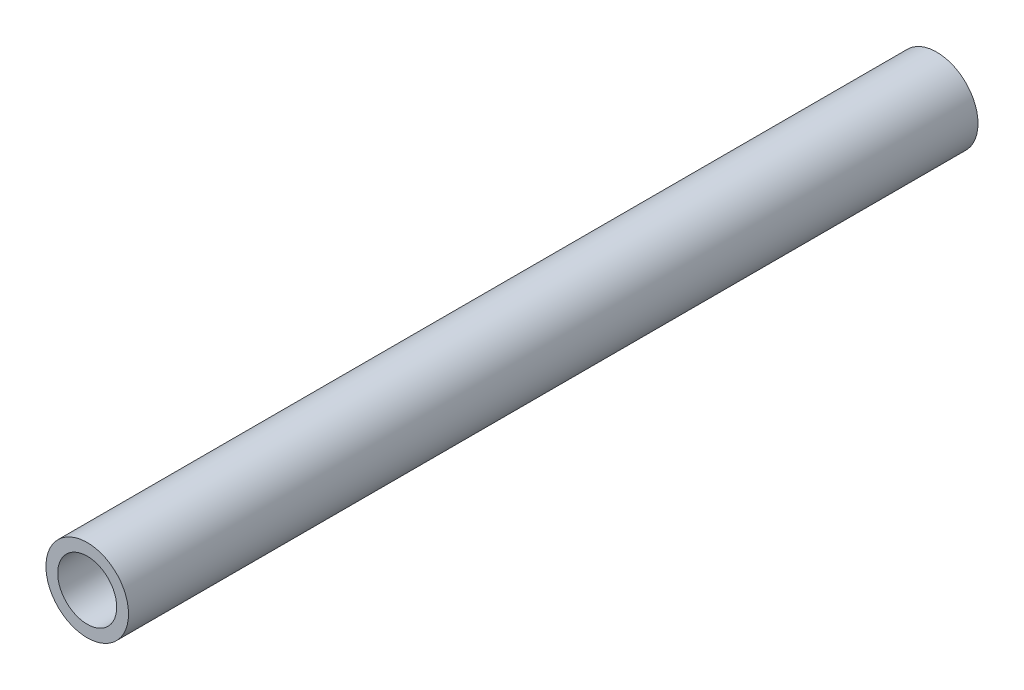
SolidWorks part; units mm, degrees
ref_plane "Front Plane" through (0, 0, 0) normal (0, 0, 1) x (1, 0, 0)
ref_plane "Top Plane" through (0, 0, 0) normal (0, 1, 0) x (1, 0, 0)
ref_plane "Right Plane" through (0, 0, 0) normal (1, 0, 0) x (0, 0, -1)
sketch "Sketch1" plane through (0, 0, 0) normal (0, 0, 1) x (1, 0, 0)
  circle A0 centre (0, 0) radius 11.1125
extrude "Extrude1" add sketch "Sketch1" along normal blind 228.6
sketch "Sketch2" plane through (0, 0, 228.6) normal (0, 0, 1) x (1, 0, 0)
  circle A0 centre (0, 0) radius 7.9375
extrude "Extrude2" cut sketch "Sketch2" against normal through all
